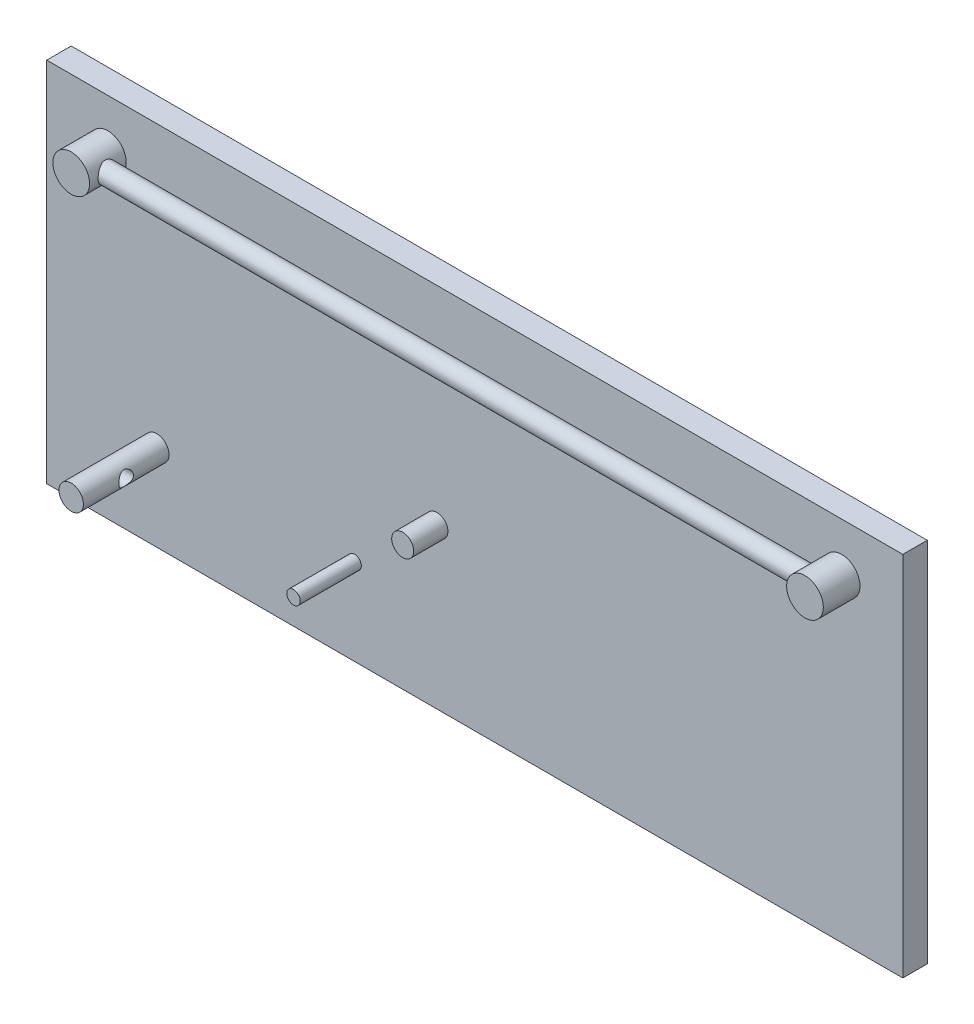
SolidWorks part; units mm, degrees
ref_plane "Front Plane" through (0, 0, 0) normal (0, 0, 1) x (1, 0, 0)
ref_plane "Top Plane" through (0, 0, 0) normal (0, 1, 0) x (1, 0, 0)
ref_plane "Right Plane" through (0, 0, 0) normal (1, 0, 0) x (0, 0, -1)
sketch "Sketch1" plane through (0, 0, 0) normal (0, 0, 1) x (1, 0, 0)
  line L0 (0, 75) -> (0, -75) construction
  line L1 (-175, 75) -> (175, 75)
  line L2 (-175, 75) -> (-175, -75)
  line L3 (-175, -75) -> (175, -75)
  line L4 (175, 75) -> (175, -75)
  dimension "D1" = 350
  dimension "D2" = 150
extrude "Extrude1" add sketch "Sketch1" along normal blind 10
sketch "Sketch2" plane through (0, 0, 10) normal (0, 0, 1) x (1, 0, 0)
  line L0 (-175, 55) -> (175, 55) construction
  line L1 (-175, 75) -> (-175, -75) construction
  line L2 (175, -75) -> (175, 75) construction
  line L3 (0, 0) -> (0, 67.7017) construction
  line L4 (175, 75) -> (-175, 75) construction
  circle A0 centre (150, 55) radius 7.5
  circle A1 centre (-150, 55) radius 7.5
  dimension "D2" = 15
  dimension "D1" = 150
  dimension "D3" = 20
extrude "Extrude2" add sketch "Sketch2" along normal blind 15
sketch "Sketch3" plane through (0, 0, 0) normal (1, 0, 0) x (0, 0, -1)
  line L0 (-25, 55) -> (-10, 55) construction
  line L1 (-25, 62.5) -> (-25, 47.5) construction
  line L2 (-10, 62.5) -> (-10, 47.5) construction
  circle A0 centre (-17.5, 55) radius 4
  dimension "D1" = 8
extrude "Extrude3" add sketch "Sketch3" along normal up to surface and the other way up to surface
sketch "Sketch4" plane through (0, 0, 10) normal (0, 0, 1) x (1, 0, 0)
  circle A0 centre (-15.474, -9.8784) radius 4.5
  dimension "D1" = 9
  dimension "D2" = 15.474
  dimension "D3" = 9.8784
extrude "Extrude4" add sketch "Sketch4" along normal blind 14
sketch "Sketch5" plane through (0, 0, 10) normal (0, 0, 1) x (1, 0, 0)
  line L0 (-175, -75) -> (175, -75) construction
  line L3 (-175, 75) -> (-175, -75) construction
  circle A0 centre (-130, -39.7624) radius 5
  dimension "D1" = 35.2376
  dimension "D3" = 10
  dimension "D2" = 45
extrude "Extrude5" add sketch "Sketch5" along normal blind 35
sketch "Sketch6" plane through (-175, 0, 0) normal (-1, 0, 0) x (0, 0, 1)
  line L0 (45, -39.7624) -> (10, -39.7624) construction
  line L1 (45, -44.7624) -> (45, -34.7624) construction
  line L2 (10, 75) -> (10, -75) construction
  circle A0 centre (27.5, -39.7624) radius 3
  dimension "D1" = 6
extrude "Cut-Extrude1" cut sketch "Sketch6" against normal up to next
sketch "Sketch7" plane through (0, 0, 10) normal (0, 0, 1) x (1, 0, 0)
  line L0 (-15.474, -39.7624) -> (-15.474, -9.8784) construction
  line L1 (-15.474, -9.8784) -> (-49.1184, -39.7624) construction
  line L2 (-49.1184, -39.7624) -> (-15.474, -39.7624) construction
  circle A0 centre (-49.1184, -39.7624) radius 2.75
  dimension "D1" = 9.8784
  dimension "D5" = 5.5
  dimension "D2" = 15.474
  dimension "D3" = 29.884
  dimension "D4" = 45
extrude "Extrude6" add sketch "Sketch7" along normal blind 25
